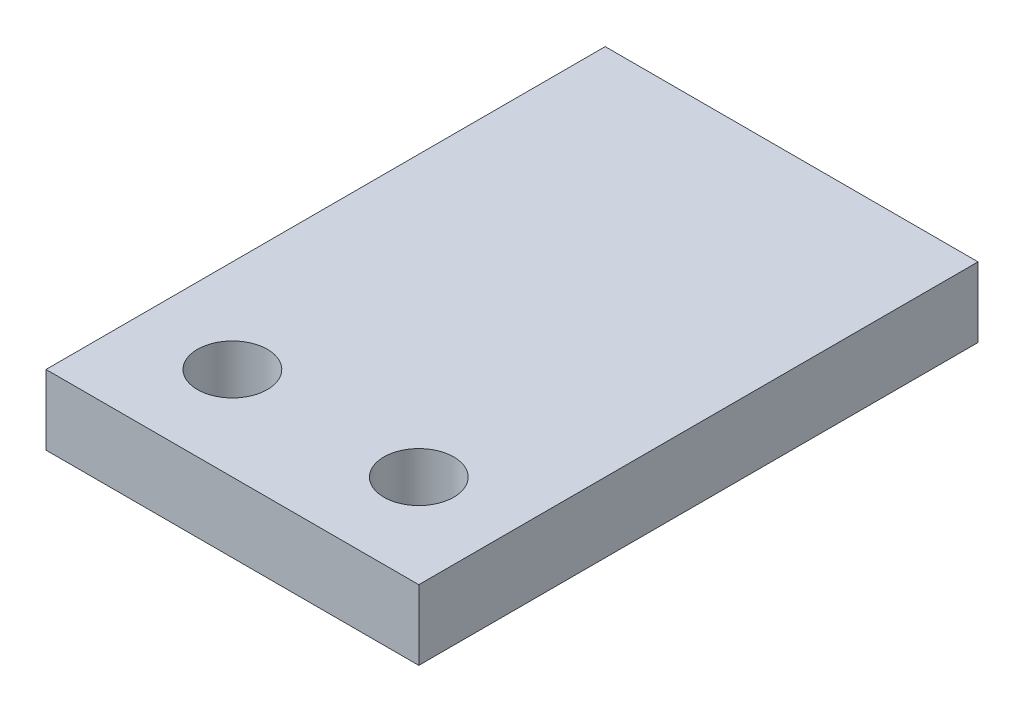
SolidWorks part; units mm, degrees
ref_plane "Front" through (0, 0, 0) normal (0, 0, 1) x (1, 0, 0)
ref_plane "Top" through (0, 0, 0) normal (0, 1, 0) x (1, 0, 0)
ref_plane "Right" through (0, 0, 0) normal (1, 0, 0) x (0, 0, -1)
sketch "Sketch1" plane through (0, 0, 0) normal (0, 1, 0) x (1, 0, 0)
  line L0 (0, 0) -> (101.6, 0)
  line L1 (0, 0) -> (0, 152.4)
  line L2 (101.6, 152.4) -> (0, 152.4)
  line L3 (101.6, 152.4) -> (101.6, 0)
  line L4 (50.8, 0) -> (50.8, 152.4) construction
  circle A0 centre (76.2, 25.4) radius 9.525
  circle A1 centre (25.4, 25.4) radius 9.525
  dimension "D3" = 25.4
  dimension "D4" = 25.4
  dimension "D5" = 19.05
  dimension "D1" = 152.4
  dimension "D2" = 101.6
extrude "Base-Extrude" add sketch "Sketch1" along normal blind 19.05
fillet "Fillet1" [suppressed] radius 3.175
fillet "Fillet2" [suppressed] radius 1.5875
